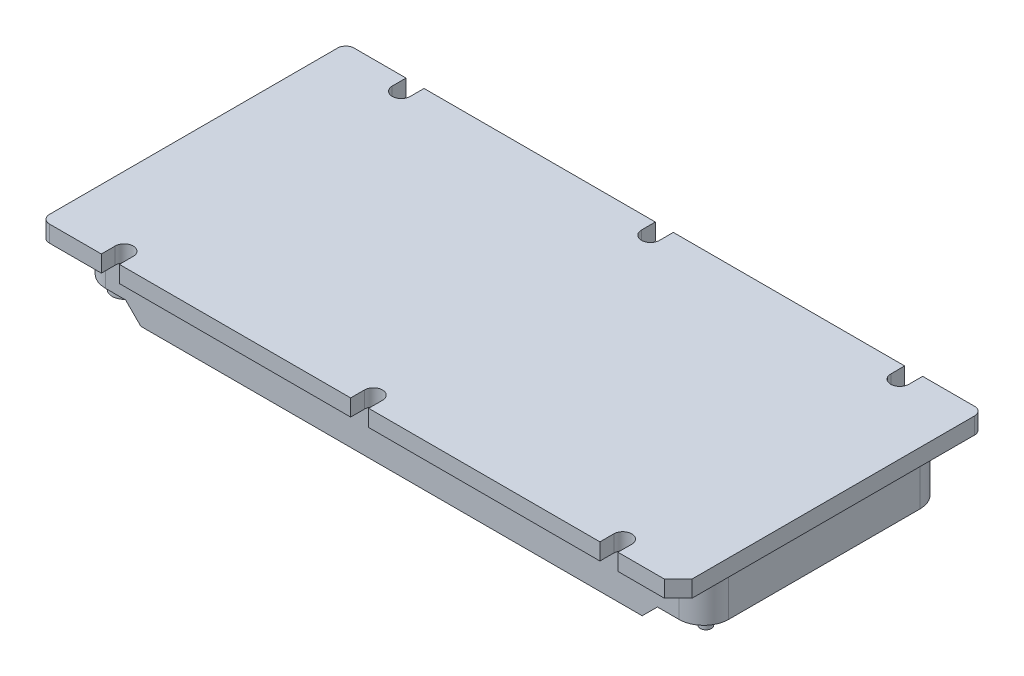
SolidWorks part; units mm, degrees
ref_plane "Front Plane" through (0, 0, 0) normal (0, 0, 1) x (1, 0, 0)
ref_plane "Top Plane" through (0, 0, 0) normal (0, 1, 0) x (1, 0, 0)
ref_plane "Right Plane" through (0, 0, 0) normal (1, 0, 0) x (0, 0, -1)
sketch "Sketch1" plane through (0, 0, 0) normal (0, 1, 0) x (1, 0, 0)
  line L0 (58.42, 0) -> (58.42, 55.88) construction
  line L1 (0, 0) -> (11.049, 0)
  line L2 (0, 0) -> (0, 55.88)
  line L3 (0, 55.88) -> (11.049, 55.88)
  line L4 (116.84, 0) -> (116.84, 55.88)
  line L5 (116.84, 27.94) -> (0, 27.94) construction
  line L6 (-11.6247, 53.34) -> (123.3847, 53.34) construction
  line L7 (-11.2168, 2.54) -> (123.7926, 2.54) construction
  line L8 (104.14, 71.9914) -> (104.14, -12.0326) construction
  line L9 (12.7, 67.5047) -> (12.7, -7.5458) construction
  line L10 (14.351, 53.34) -> (14.351, 55.88)
  line L11 (11.049, 53.34) -> (11.049, 55.88)
  line L12 (14.351, 0) -> (56.769, 0)
  line L13 (14.351, 55.88) -> (56.769, 55.88)
  line L14 (60.071, 53.34) -> (60.071, 55.88)
  line L15 (56.769, 53.34) -> (56.769, 55.88)
  line L16 (60.071, 0) -> (102.489, 0)
  line L17 (105.791, 53.34) -> (105.791, 55.88)
  line L18 (102.489, 53.34) -> (102.489, 55.88)
  line L19 (60.071, 55.88) -> (102.489, 55.88)
  line L21 (102.489, 2.54) -> (102.489, 0)
  line L22 (105.791, 2.54) -> (105.791, 0)
  line L23 (105.791, 0) -> (116.84, 0)
  line L24 (56.769, 2.54) -> (56.769, 0)
  line L25 (60.071, 2.54) -> (60.071, 0)
  line L27 (11.049, 2.54) -> (11.049, 0)
  line L28 (14.351, 2.54) -> (14.351, 0)
  line L29 (105.791, 55.88) -> (116.84, 55.88)
  arc A0 (11.049, 53.34) -> (14.351, 53.34) centre (12.7, 53.34) ccw
  arc A1 (56.769, 53.34) -> (60.071, 53.34) centre (58.42, 53.34) ccw
  arc A2 (102.489, 53.34) -> (105.791, 53.34) centre (104.14, 53.34) ccw
  arc A3 (102.489, 2.54) -> (105.791, 2.54) centre (104.14, 2.54) cw
  arc A4 (56.769, 2.54) -> (60.071, 2.54) centre (58.42, 2.54) cw
  arc A5 (11.049, 2.54) -> (14.351, 2.54) centre (12.7, 2.54) cw
  dimension "D7" = 3.302
  dimension "D1" = 55.88
  dimension "D2" = 116.84
  dimension "D3" = 2.54
  dimension "D4" = 2.54
  dimension "D5" = 45.72
  dimension "D6" = 45.72
extrude "Extrude1" add sketch "Sketch1" along normal blind 3.048
chamfer "Chamfer1" distance 2.54 angle 45 1 edges at (116.84, 1.524, 0)
fillet "Fillet1" radius 1.524 3 edges at (0, 1.524, 0) (0, 1.524, -55.88) (116.84, 1.524, -55.88)
sketch "Sketch2" plane through (0, 0, 0) normal (0, -1, 0) x (1, 0, 0)
  line L0 (0, -27.94) -> (10.9616, -27.94) construction
  line L1 (111.1243, -5.842) -> (5.9683, -5.842)
  line L2 (115.6963, -10.414) -> (115.6963, -45.466)
  line L3 (111.1243, -50.038) -> (5.9683, -50.038)
  line L4 (1.3963, -10.414) -> (1.3963, -45.466)
  line L7 (0, -54.356) -> (0, -1.524) construction
  arc A0 (5.9683, -50.038) -> (1.3963, -45.466) centre (5.9683, -45.466) cw
  arc A1 (5.9683, -5.842) -> (1.3963, -10.414) centre (5.9683, -10.414) ccw
  arc A2 (111.1243, -5.842) -> (115.6963, -10.414) centre (111.1243, -10.414) cw
  arc A3 (115.6963, -45.466) -> (111.1243, -50.038) centre (111.1243, -45.466) cw
  point P10 (1.3963, -50.038)
  point P15 (115.6963, -5.842)
  point P18 (115.6963, -50.038)
  dimension "D4" = 4.572
  dimension "D1" = 44.196
  dimension "D2" = 22.098
  dimension "D3" = 114.3
extrude "Extrude2" add sketch "Sketch2" along normal blind 10.668
sketch "Sketch3" plane through (0, 0, -50.038) normal (0, 0, -1) x (-1, 0, 0)
  line L0 (-118.9721, -7.874) -> (2.8902, -7.874) construction
  line L1 (-56.769, 3.048) -> (-14.351, 3.048) construction
  line L2 (-107.188, -7.874) -> (-107.188, 5.7608) construction
  line L3 (-116.84, 0) -> (-116.84, 3.048) construction
  line L4 (-118.9721, -7.874) -> (-107.188, -7.874)
  line L5 (-107.188, -7.874) -> (-104.394, -10.668)
  line L6 (-5.9683, -10.668) -> (-111.1243, -10.668) construction
  line L7 (-104.394, -10.668) -> (-104.394, -13.0018)
  line L8 (-104.394, -13.0018) -> (-118.9721, -13.0018)
  line L9 (-118.9721, -13.0018) -> (-118.9721, -7.874)
  line L10 (-58.42, 3.048) -> (-58.42, 10.6884) construction
  line L11 (-56.769, 3.048) -> (-60.071, 3.048) construction
  line L12 (2.1321, -13.0018) -> (2.1321, -7.874)
  line L13 (-12.446, -13.0018) -> (2.1321, -13.0018)
  line L14 (-12.446, -10.668) -> (-12.446, -13.0018)
  line L15 (-9.652, -7.874) -> (-12.446, -10.668)
  line L16 (2.1321, -7.874) -> (-9.652, -7.874)
  dimension "D1" = 10.922
  dimension "D2" = 9.652
extrude "Cut-Extrude1" cut sketch "Sketch3" against normal through all
sketch "Sketch4" plane through (0, -7.874, 0) normal (0, -1, 0) x (1, 0, 0)
  line L0 (5.08, 8.9721) -> (5.08, -61.4184) construction
  line L1 (115.6963, -27.94) -> (1.3963, -27.94) construction
  line L3 (58.42, -2.54) -> (58.42, -61.4184) construction
  line L5 (1.3963, -45.466) -> (1.3963, -10.414) construction
  circle A1 centre (5.08, -27.94) radius 1.016
  circle A2 centre (5.08, -45.72) radius 2.2074
  circle A3 centre (5.08, -10.16) radius 2.2074
  circle A4 centre (5.08, -20.32) radius 1.016
  circle A5 centre (5.08, -35.56) radius 1.016
  circle A7 centre (111.76, -35.56) radius 1.016
  circle A9 centre (111.76, -20.32) radius 1.016
  circle A11 centre (111.76, -10.16) radius 1.016
  circle A12 centre (111.76, -45.72) radius 1.016
  dimension "D2" = 2.032
  dimension "D4" = 10.16
extrude "Extrude3" add sketch "Sketch4" along normal blind 5.588
ref_plane "Plane1" through (0, -10.668, 0) normal (0, 1, 0) x (-1, 0, 0)
sketch "Sketch5" plane through (0, -10.668, 0) normal (0, 1, 0) x (-1, 0, 0)
  line L1 (-126.207, 8.5463) -> (10.3389, 8.5463)
  line L2 (-126.207, 8.5463) -> (-126.207, -61.1728)
  line L3 (-126.207, -61.1728) -> (10.3389, -61.1728)
  line L4 (10.3389, 8.5463) -> (10.3389, -61.1728)
extrude "Cut-Extrude2" cut sketch "Sketch5" against normal blind 5.588
sketch "Sketch6"
extrude "Cut-Extrude3" cut sketch "Sketch6" against normal blind 0.7937
